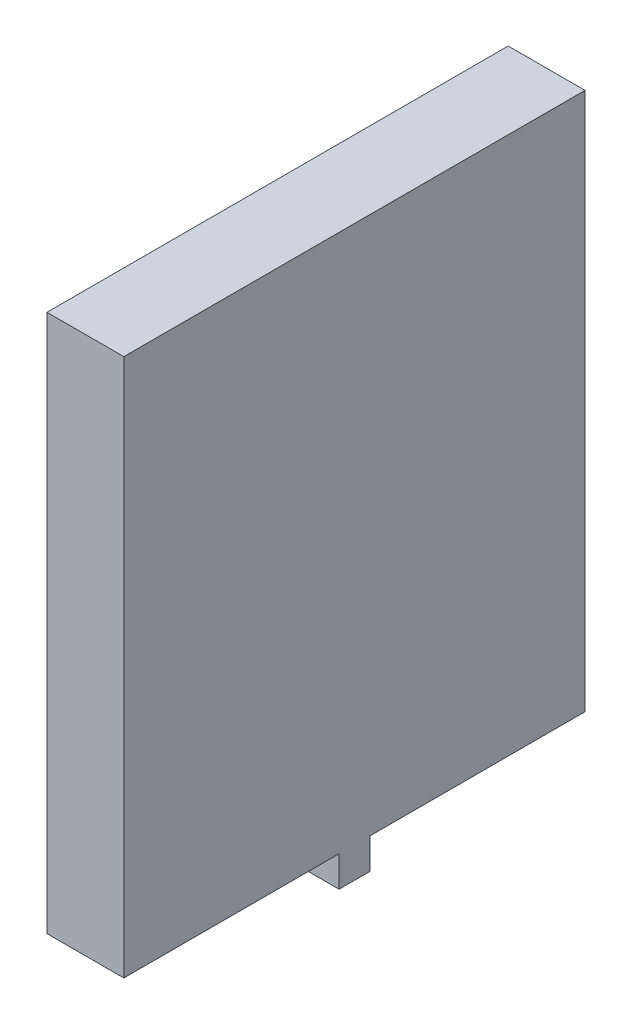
SolidWorks part; units mm, degrees
ref_plane "Alzado" through (0, 0, 0) normal (0, 0, 1) x (1, 0, 0)
ref_plane "Planta" through (0, 0, 0) normal (0, 1, 0) x (1, 0, 0)
ref_plane "Vista lateral" through (0, 0, 0) normal (1, 0, 0) x (0, 0, -1)
sketch "Croquis1" plane through (0, 0, 0) normal (1, 0, 0) x (0, 0, -1)
  line L1 (-30, -35) -> (30, -35)
  line L2 (-30, -35) -> (-30, 35)
  line L3 (-30, 35) -> (30, 35)
  line L4 (30, -35) -> (30, 35)
  line L5 (-30, -35) -> (30, 35) construction
  line L6 (-30, 35) -> (30, -35) construction
  point P0 (0, 0)
  dimension "D1" = 60
  dimension "D2" = 70
extrude "Saliente-Extruir1" add sketch "Croquis1" along normal blind 10
sketch "Croquis2" plane through (0, 0, 0) normal (-1, 0, 0) x (0, 0, 1)
  line L0 (0, -35) -> (0, -30) construction
  line L1 (30, -35) -> (-30, -35) construction
  line L3 (-7.5, -25) -> (7.5, -25)
  line L4 (-7.5, -25) -> (-7.5, -35)
  line L5 (-7.5, -35) -> (7.5, -35)
  line L6 (7.5, -25) -> (7.5, -35)
  line L7 (-7.5, -25) -> (7.5, -35) construction
  line L8 (-7.5, -35) -> (7.5, -25) construction
  dimension "D1" = 15
  dimension "D2" = 10
extrude "Saliente-Extruir2" add sketch "Croquis2" along normal blind 20
sketch "Croquis3" plane through (0, -25, 0) normal (0, 1, 0) x (1, 0, 0)
  line L0 (-20, 0) -> (-14, 0) construction
  line L1 (-20, -7.5) -> (-20, 7.5) construction
  circle A0 centre (-14, 0) radius 3.5
  dimension "D1" = 7
  dimension "D2" = 6
extrude "Cortar-Extruir1" cut sketch "Croquis3" against normal blind 30
sketch "Croquis4" plane through (0, -35, 0) normal (0, -1, 0) x (1, 0, 0)
  line L0 (10, 0) -> (5, 0) construction
  line L1 (10, 30) -> (10, -30) construction
  line L3 (0, -2) -> (10, -2)
  line L4 (0, -2) -> (0, 2)
  line L5 (0, 2) -> (10, 2)
  line L6 (10, -2) -> (10, 2)
  line L7 (0, -2) -> (10, 2) construction
  line L8 (0, 2) -> (10, -2) construction
  dimension "D1" = 5
  dimension "D2" = 4
extrude "Saliente-Extruir3" add sketch "Croquis4" along normal blind 4
